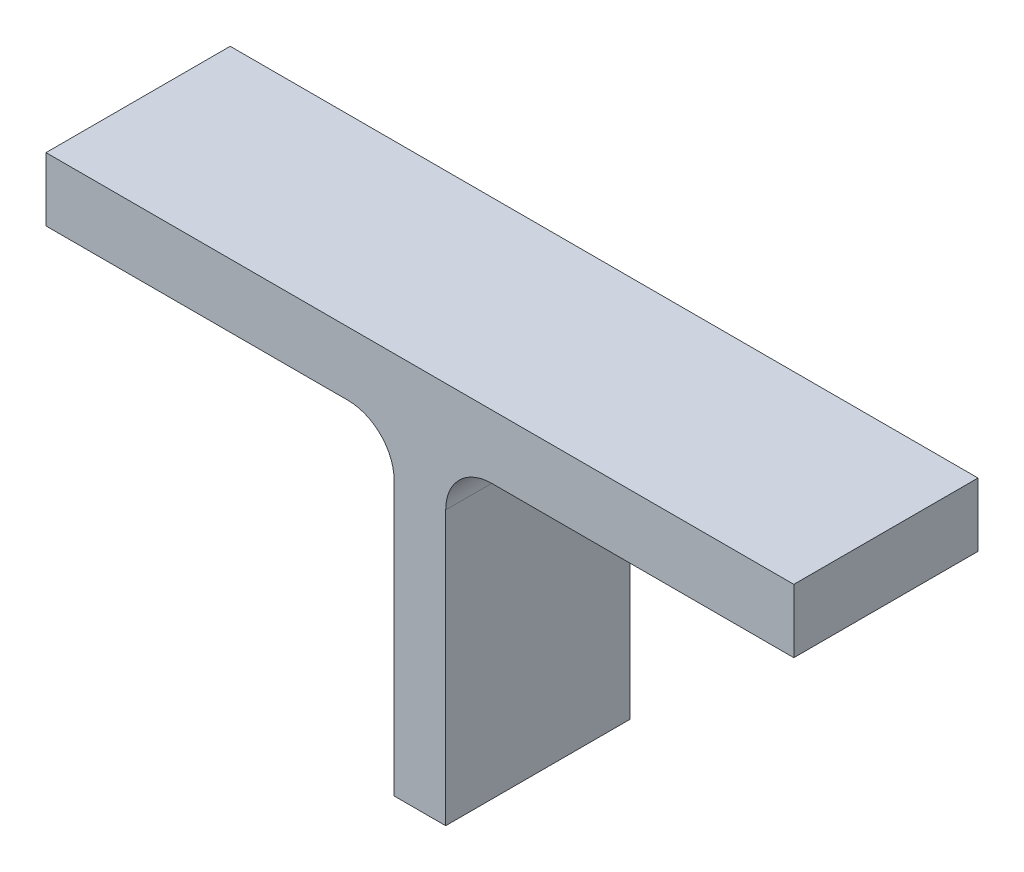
SolidWorks part; units mm, degrees
ref_plane "Plane1" through (0, 0, 0) normal (0, 0, 1) x (1, 0, 0)
ref_plane "Plane2" through (0, 0, 0) normal (0, 1, 0) x (1, 0, 0)
ref_plane "Plane3" through (0, 0, 0) normal (1, 0, 0) x (0, 0, -1)
sketch "Sketch1" plane through (0, 0, 0) normal (0, 0, 1) x (1, 0, 0)
  line L0 (-3.556, 0) -> (3.556, 0)
  line L2 (-3.556, 0) -> (-3.556, 37.719)
  line L3 (-9.906, 44.069) -> (-51.562, 44.069)
  line L4 (-51.562, 44.069) -> (-51.562, 52.832)
  line L5 (-51.562, 52.832) -> (51.562, 52.832)
  line L6 (51.562, 52.832) -> (51.562, 44.069)
  line L7 (51.562, 44.069) -> (9.906, 44.069)
  line L8 (3.556, 37.719) -> (3.556, 0)
  line L12 (0, 0) -> (0, 52.832) construction
  arc A1 (-3.556, 37.719) -> (-9.906, 44.069) centre (-9.906, 37.719) ccw
  arc A2 (9.906, 44.069) -> (3.556, 37.719) centre (9.906, 37.719) ccw
extrude "BaseSteelWT" add sketch "Sketch1" against normal mid plane 25.4
equation "\"D1@Sketch1\" = \"Tw@Sketch1\" / 2"
